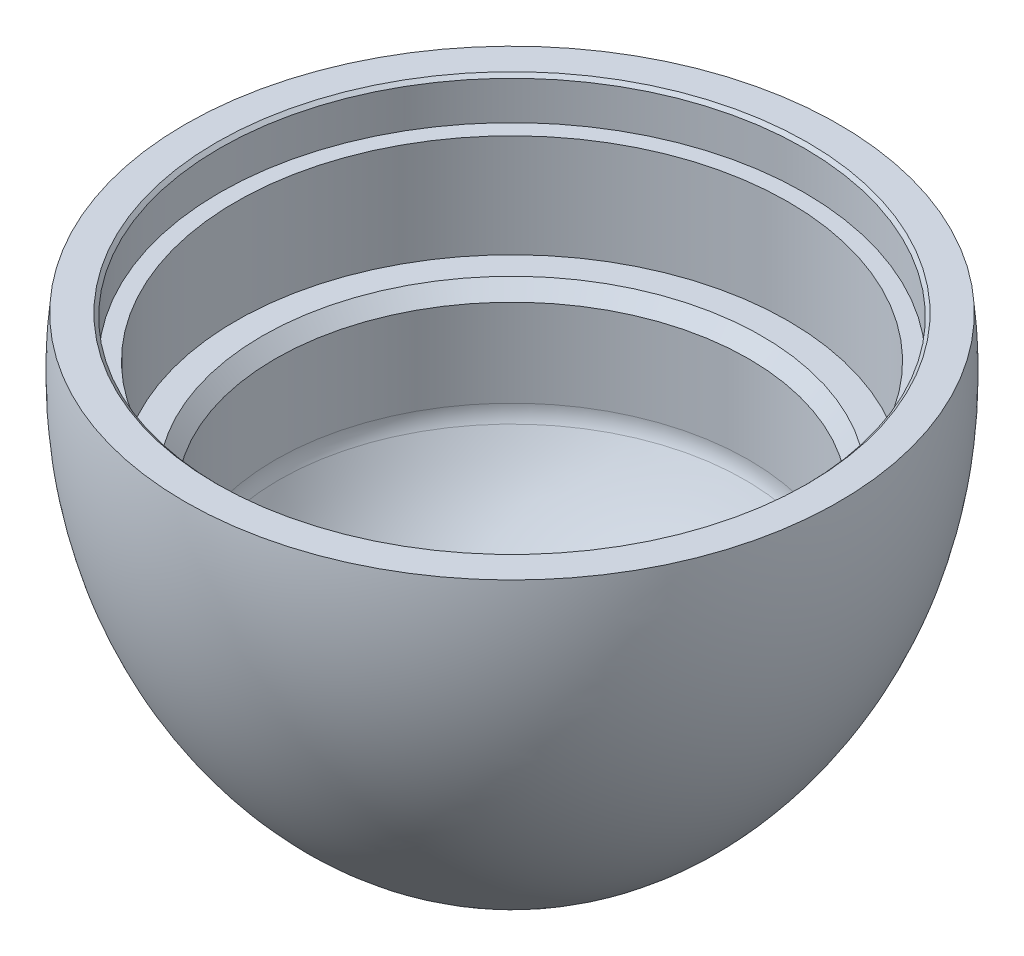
SolidWorks part; units mm, degrees
ref_plane "Front Plane" through (0, 0, 0) normal (0, 0, 1) x (1, 0, 0)
ref_plane "Top Plane" through (0, 0, 0) normal (0, 1, 0) x (1, 0, 0)
ref_plane "Right Plane" through (0, 0, 0) normal (1, 0, 0) x (0, 0, -1)
ref_plane "Overlap Plane" through (0, -9, 0) normal (0, 1, 0) x (1, 0, 0)
sketch "Sketch3" plane through (0, 0, 0) normal (0, 0, 1) x (1, 0, 0)
  line L0 (24.6, 124.6) -> (95.0695, 124.6) construction
  line L1 (0, 33.437) -> (0, -51.8457) construction
  line L2 (0, -19.8647) -> (0, 18.7433)
  spline S0 degree 3 poles (0, 18.7433) (-1.3722, 18.7433) (-4.5451, 17.7845) (-8.8778, 13.2617) (-11.2201, 9.1437) (-14.6755, -0.9262) (-12.9896, -13.0562) (-5.3082, -20.0572) (0, -19.8647) knots 0 0 0 0 0.097127 0.127739 0.306118 0.478065 0.702771 1 1 1 1
  dimension "D1" = 13.7295
  dimension "D2" = 38.608
revolve "Revolve1" add sketch "Sketch3" angle 360 about L1
scale "Scale1" scale about centroid uniform scaling yes scale factor 1.8
sketch "Sketch4" plane through (0, 0, 0) normal (0, 1, 0) x (1, 0, 0)
  circle A0 centre (0, 0) radius 39.8037
extrude "Cut-Extrude1" cut sketch "Sketch4" along normal through all
sketch "Sketch5" plane through (0, 0, 0) normal (0, 1, 0) x (1, 0, 0)
  circle A0 centre (0, 0.0002) radius 21
  dimension "D1" = 42
extrude "Cut-Extrude2" cut sketch "Sketch5" against normal offset from surface (11.008 mm away) 2.008
sketch "Sketch7" plane through (0, 0, 0) normal (0, 0, 1) x (1, 0, 0)
  line L0 (0, 0) -> (0, -31.328) construction
  line L1 (21, -11.008) -> (-21, -11.008) construction
  line L2 (-18, -11.008) -> (0, -11.008)
  line L3 (0, -11.008) -> (0, -31.328)
  line L4 (-18, -11.008) -> (-18, -19.2703)
  line L5 (0, -31.328) -> (-6.35, -31.328)
  line L6 (0, -30.5514) -> (0, -46.7356) construction
  spline S0 degree 3 poles (-6.35, -31.328) (-7.8486, -30.8462) (-14.2573, -25.1788) (-16.1831, -22.8809) (-18, -19.2703) knots 0.191161 0.191161 0.191161 0.191161 0.339329 0.707022 0.707022 0.707022 0.707022
  dimension "D1" = 4
  dimension "D2" = 18
  dimension "D3" = 6.35
  dimension "D4" = 20.32
revolve "Cut-Revolve1" cut sketch "Sketch7" angle 360 about L0
sketch "Sketch8" plane through (0, 0, 0) normal (1, 0, 0) x (0, 0, -1)
  line L2 (-22.225, 0) -> (-22.225, -3.175)
  line L3 (-22.225, -3.175) -> (0, -3.175)
  line L4 (0, -3.175) -> (0, 0)
  line L5 (21.0002, 0) -> (-20.9998, 0) construction
  line L6 (0, 0) -> (-22.225, 0)
  line L7 (0, 0) -> (0, -23.108) construction
  dimension "D1" = 3.175
  dimension "D4" = 44.45
revolve "Cut-Revolve2" cut sketch "Sketch8" angle 360 about L7
sketch "Sketch9" plane through (0, 0, 0) normal (1, 0, 0) x (0, 0, -1)
  line L0 (24.8565, 0) -> (-24.8561, 0) construction
  line L1 (25.3458, 0) -> (-25.4542, 0)
  line L2 (25.3458, 0) -> (25.3458, -35.0051)
  line L3 (25.3458, -35.0051) -> (-25.4542, -35.0051)
  line L4 (-25.4542, 0) -> (-25.4542, -35.0051)
  line L5 (40.0858, -9.6051) -> (26.664, -9.6051)
  dimension "D1" = 35.0051
  dimension "D2" = 50.8
  dimension "D3" = 25.4
chamfer "Chamfer1" distance 1 angle 45 1 edges at (-18, -11.008, 0)
fillet "Fillet1" radius 2.54 2 edges at (-18, -19.2703, 0) (-6.35, -31.328, 0)
chamfer "Chamfer2" distance 0.254 angle 45 1 edges at (0, 0, 22.225)
sketch "Sketch10" plane through (0, 0, 0) normal (0, 0, 1) x (1, 0, 0)
  line L0 (-22.225, -17.8632) -> (22.225, -17.8632)
  line L1 (24.9362, -6.97) -> (-24.9362, -6.97)
  spline S0 degree 3 number of poles 345 (0.6636, -34.5635) -> (24.8563, 0) construction
  spline S1 degree 3 number of poles 345 (0.6636, -34.5635) -> (24.8563, 0)
  spline S2 degree 3 number of poles 338 (-24.8563, 0) -> (-0.6636, -34.5635) construction
  spline S3 degree 3 number of poles 338 (-24.8563, 0) -> (-0.6636, -34.5635)
  dimension "D1" = 44.45
  dimension "D2" = 49.8724
